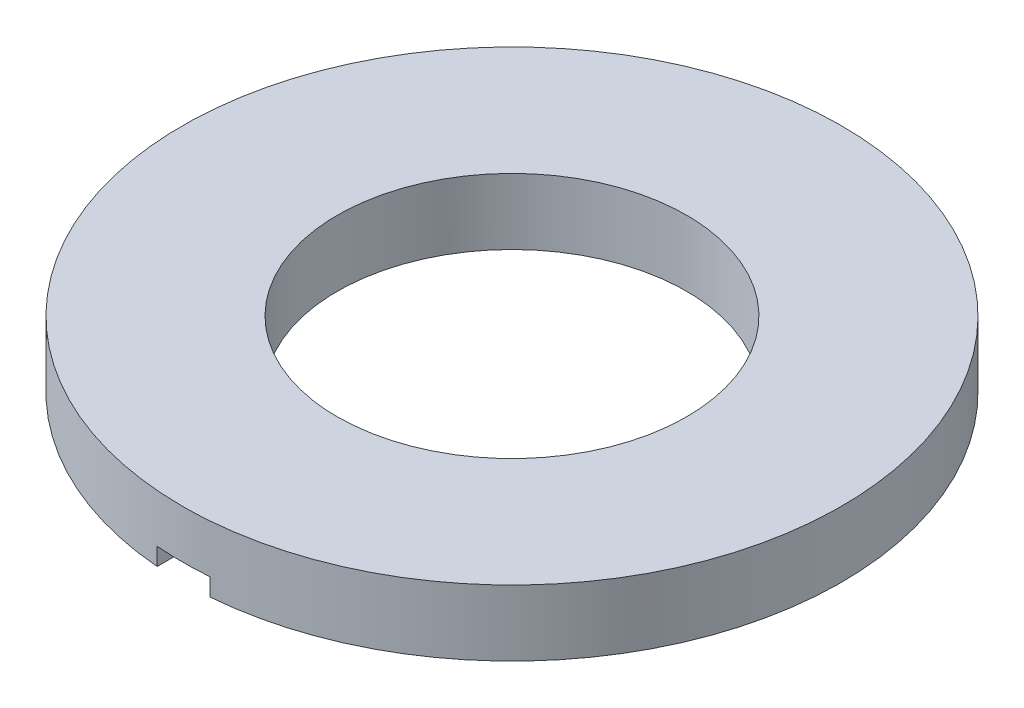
SolidWorks part; units mm, degrees
ref_plane "Front Plane" through (0, 0, 0) normal (0, 0, 1) x (1, 0, 0)
ref_plane "Top Plane" through (0, 0, 0) normal (0, 1, 0) x (1, 0, 0)
ref_plane "Right Plane" through (0, 0, 0) normal (1, 0, 0) x (0, 0, -1)
sketch "Sketch1" plane through (0, 0, 0) normal (0, 1, 0) x (1, 0, 0)
  circle A0 centre (0, 0) radius 2.65
  circle A1 centre (0, 0) radius 5
  dimension "D1" = 5.3
  dimension "D2" = 10
extrude "Extrude1" add sketch "Sketch1" along normal blind 1
sketch "Sketch2" plane through (0, 0, 0) normal (0, -1, 0) x (1, 0, 0)
  line L1 (-0.4, 0.3) -> (0.4, 0.3)
  line L2 (-0.4, 0.3) -> (-0.4, 5)
  line L3 (-0.4, 5) -> (0.4, 5)
  line L4 (0.4, 0.3) -> (0.4, 5)
  line L5 (-0.4, 0.3) -> (0.4, 5) construction
  line L6 (-0.4, 5) -> (0.4, 0.3) construction
  circle A0 centre (0, 0) radius 2.65 construction
  circle A1 centre (0, 0) radius 5 construction
  point P0 (0, 2.65)
  dimension "D1" = 0.8
extrude "Cut-Extrude1" cut sketch "Sketch2" against normal blind 0.2667
